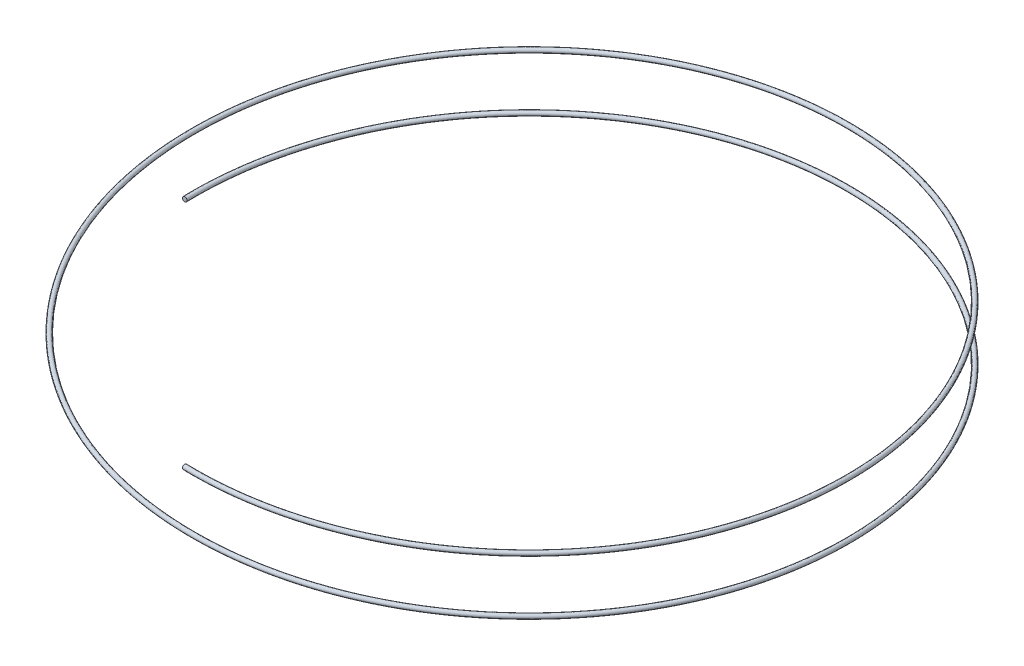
SolidWorks part; units mm, degrees
ref_plane "Alzado" through (0, 0, 0) normal (0, 0, 1) x (1, 0, 0)
ref_plane "Planta" through (0, 0, 0) normal (0, 1, 0) x (1, 0, 0)
ref_plane "Vista lateral" through (0, 0, 0) normal (1, 0, 0) x (0, 0, -1)
sketch "Croquis1" plane through (0, 0, 0) normal (0, 1, 0) x (1, 0, 0)
  circle A0 centre (0, 0) radius 65.9538
curve "Hélice/Espiral1"
sketch "Croquis3" plane through (0, 0, 0) normal (0, 0, 1) x (1, 0, 0)
  circle A0 centre (-65.9538, 0) radius 0.4635
  spline S0 degree 3 number of poles 66 (-65.9538, 0) -> (0, 19.25) construction
sweep "Barrer1" add profiles "Croquis3" path "Hélice/Espiral1"
